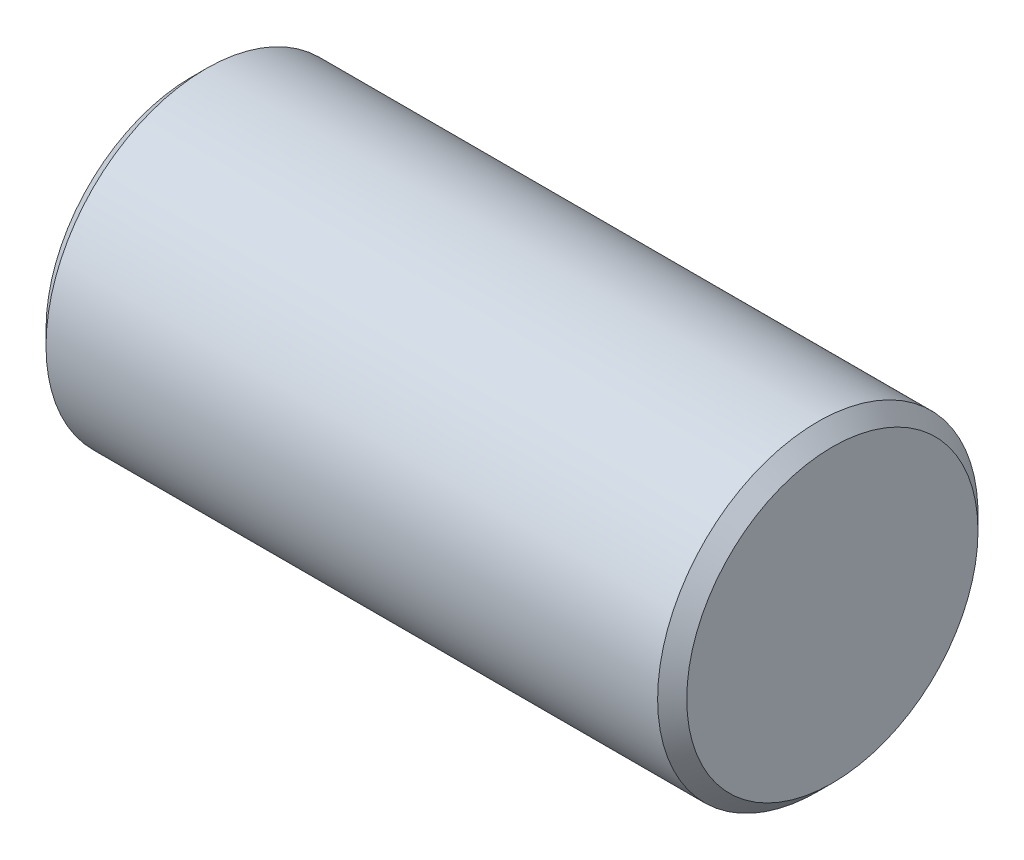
SolidWorks part; units mm, degrees
ref_plane "Plan de face" through (0, 0, 0) normal (0, 0, 1) x (1, 0, 0)
ref_plane "Plan de dessus" through (0, 0, 0) normal (0, 1, 0) x (1, 0, 0)
ref_plane "Plan de droite" through (0, 0, 0) normal (1, 0, 0) x (0, 0, -1)
sketch "Esquisse1" plane through (0, 0, 0) normal (0, 0, 1) x (1, 0, 0)
  line L1 (0, 0) -> (44, 0)
  line L2 (0, 0) -> (0, -11)
  line L3 (0, -11) -> (44, -11)
  line L4 (44, 0) -> (44, -11)
  dimension "D1" = 11
  dimension "D2" = 44
revolve "Révolution1" add sketch "Esquisse1" angle 360 about L3
chamfer "Chanfrein1" distance 1 angle 45 2 edges at (44, -11, 11) (0, -11, 11)
